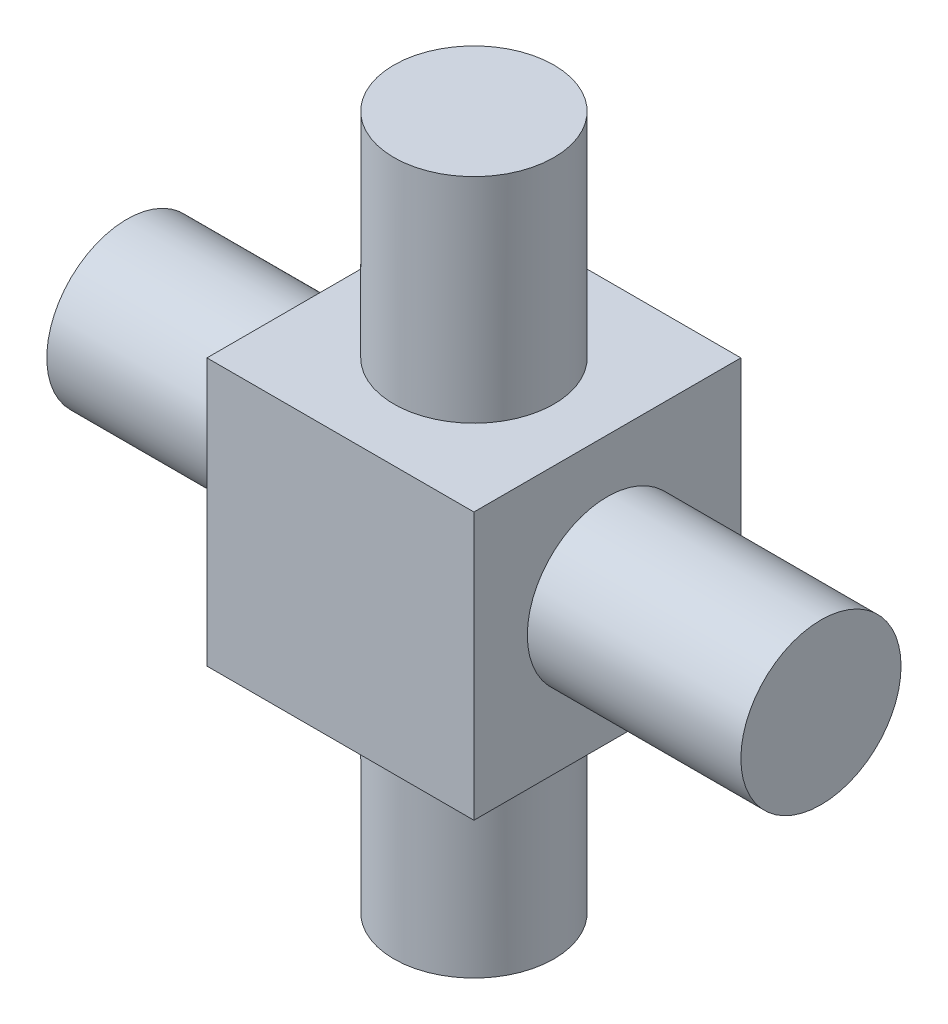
SolidWorks part; units mm, degrees
ref_plane "Front Plane" through (0, 0, 0) normal (0, 0, 1) x (1, 0, 0)
ref_plane "Top Plane" through (0, 0, 0) normal (0, 1, 0) x (1, 0, 0)
ref_plane "Right Plane" through (0, 0, 0) normal (1, 0, 0) x (0, 0, -1)
sketch "Sketch1" plane through (0, 0, 0) normal (0, 1, 0) x (1, 0, 0)
  line L1 (-25, -25) -> (25, -25)
  line L2 (-25, -25) -> (-25, 25)
  line L3 (-25, 25) -> (25, 25)
  line L4 (25, -25) -> (25, 25)
  line L5 (-25, -25) -> (25, 25) construction
  line L6 (-25, 25) -> (25, -25) construction
  point P0 (0, 0)
  dimension "D1" = 50
  dimension "D2" = 50
extrude "Boss-Extrude1" add sketch "Sketch1" along normal mid plane 50
sketch "Sketch2" plane through (0, 0, 0) normal (0, 1, 0) x (1, 0, 0)
  circle A0 centre (0, 0) radius 15
  dimension "D1" = 30
extrude "Boss-Extrude2" add sketch "Sketch2" along normal mid plane 130
sketch "Sketch3" plane through (0, 0, 0) normal (1, 0, 0) x (0, 0, -1)
  circle A0 centre (0, 0) radius 15
  dimension "D1" = 30
extrude "Boss-Extrude3" add sketch "Sketch3" along normal mid plane 130
